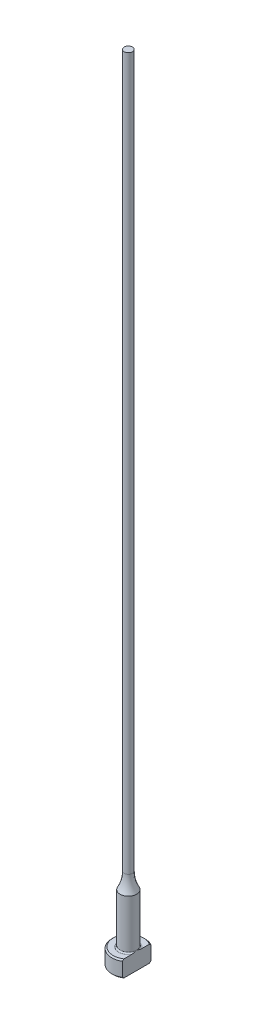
SolidWorks part; units mm, degrees
ref_plane "Front Plane" through (0, 0, 0) normal (0, 0, 1) x (1, 0, 0)
ref_plane "Top Plane" through (0, 0, 0) normal (0, 1, 0) x (1, 0, 0)
ref_plane "Right Plane" through (0, 0, 0) normal (1, 0, 0) x (0, 0, -1)
sketch "Sketch1" plane through (0, 0, 0) normal (0, 0, 1) x (1, 0, 0)
  line L0 (0, 259.9588) -> (0, -15.1925) construction
  line L1 (0, 0) -> (-3.175, 0)
  line L2 (-3.175, 0) -> (-3.175, 3.175)
  line L3 (-3.175, 3.175) -> (-1.5875, 3.175)
  line L4 (-0.7937, 15.7742) -> (-0.7937, 152.4)
  line L5 (-0.7937, 152.4) -> (0, 152.4)
  line L6 (0, 152.4) -> (0, 0)
  line L7 (-1.5875, 3.175) -> (-1.5875, 12.7)
  arc A0 (-1.5875, 12.7) -> (-0.7937, 15.7742) centre (-7.1437, 15.7742) ccw
  point P13 (-1.5875, 0)
  dimension "D1" = 6.35
  dimension "L" = 152.4
  dimension "D2" = 3.175
  dimension "H" = 6.35
  dimension "T" = 3.175
  dimension "D" = 1.5875
  dimension "S" = 12.7
revolve "Revolve1" add sketch "Sketch1" angle 360 about L0
chamfer "Chamfer1" distance 0.254 angle 45 2 edges at (0, 3.175, 3.175) (0, 0, 3.175)
fillet "Fillet1" radius 0.254 1 edges at (0, 3.175, 1.5875)
sketch "Sketch2" plane through (0, 0, 0) normal (0, 1, 0) x (1, 0, 0)
  line L0 (1.5875, -2.7496) -> (1.5875, 2.7496)
  circle A0 centre (0, 0) radius 3.175 construction
  arc A2 (1.5875, -2.7496) -> (1.5875, 2.7496) centre (0, 0) ccw
  circle A3 centre (0, 0) radius 3.175 construction
  circle A4 centre (0, 0) radius 1.5875 construction
extrude "Key Head" cut sketch "Sketch2" along normal up to next
